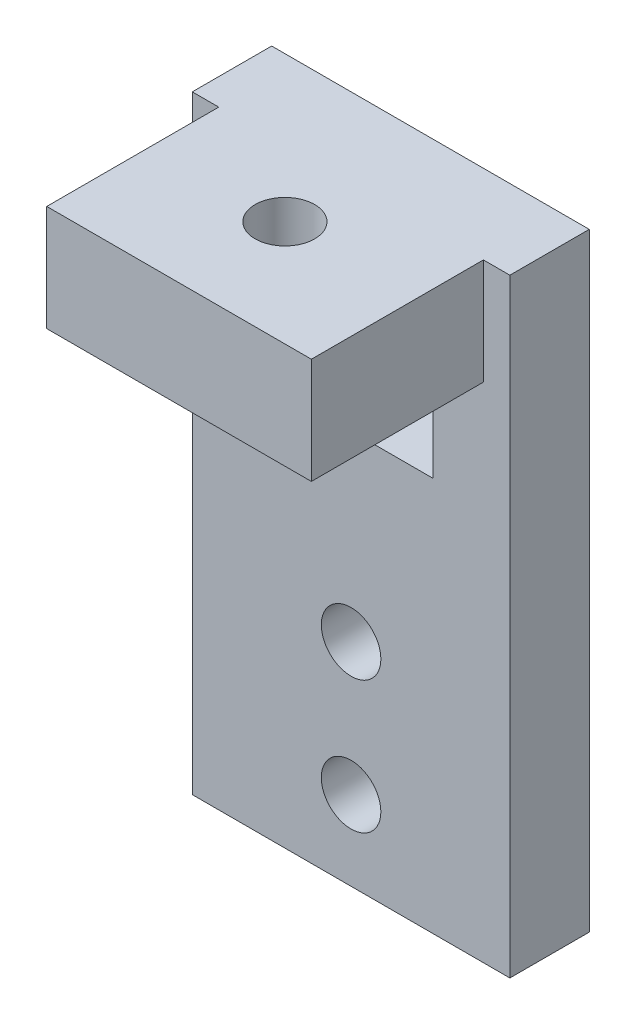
SolidWorks part; units mm, degrees
ref_plane "前视基准面" through (0, 0, 0) normal (0, 0, 1) x (1, 0, 0)
ref_plane "上视基准面" through (0, 0, 0) normal (0, 1, 0) x (1, 0, 0)
ref_plane "右视基准面" through (0, 0, 0) normal (1, 0, 0) x (0, 0, -1)
other "Configuration Table"
sketch "草图1" plane through (0, 0, 0) normal (0, 0, 1) x (1, 0, 0)
  line L0 (-12, -38) -> (12, -38)
  line L1 (12, -38) -> (12, 8)
  line L2 (12, 8) -> (-12, 8)
  line L3 (-12, 8) -> (-12, -38)
  line L4 (-6.2, -8.2) -> (6.2, -8.2)
  line L5 (6.2, -8.2) -> (6.2, 0.2)
  line L6 (6.2, 0.2) -> (-6.2, 0.2)
  line L7 (-6.2, 0.2) -> (-6.2, -8.2)
  circle A0 centre (0, -32) radius 2.25
  circle A1 centre (0, -22) radius 2.25
  dimension "D1" = 4.5
  dimension "D2" = 6.2
  dimension "D3" = 12
  dimension "D4" = 6.2
  dimension "D5" = 12
  dimension "D6" = 0.2
  dimension "D7" = 8
  dimension "D8" = 8.2
  dimension "D9" = 22
  dimension "D10" = 32
  dimension "D11" = 38
extrude "Shoe_foot_M4_clearance" add sketch "草图1" along normal blind 6
sketch "草图2" plane through (0, 0, 0) normal (0, 1, 0) x (1, 0, 0)
  line L0 (-10, -6) -> (10, -6)
  line L1 (10, -6) -> (10, -19)
  line L2 (10, -19) -> (-10, -19)
  line L3 (-10, -19) -> (-10, -6)
  circle A0 centre (0, -11) radius 2.25
  dimension "D1" = 4.5
  dimension "D2" = 10
  dimension "D3" = 10
  dimension "D4" = 6
  dimension "D5" = 11
  dimension "D6" = 19
extrude "Upright_fixed_M4_cross_bolt" add sketch "草图2" along normal blind 8
